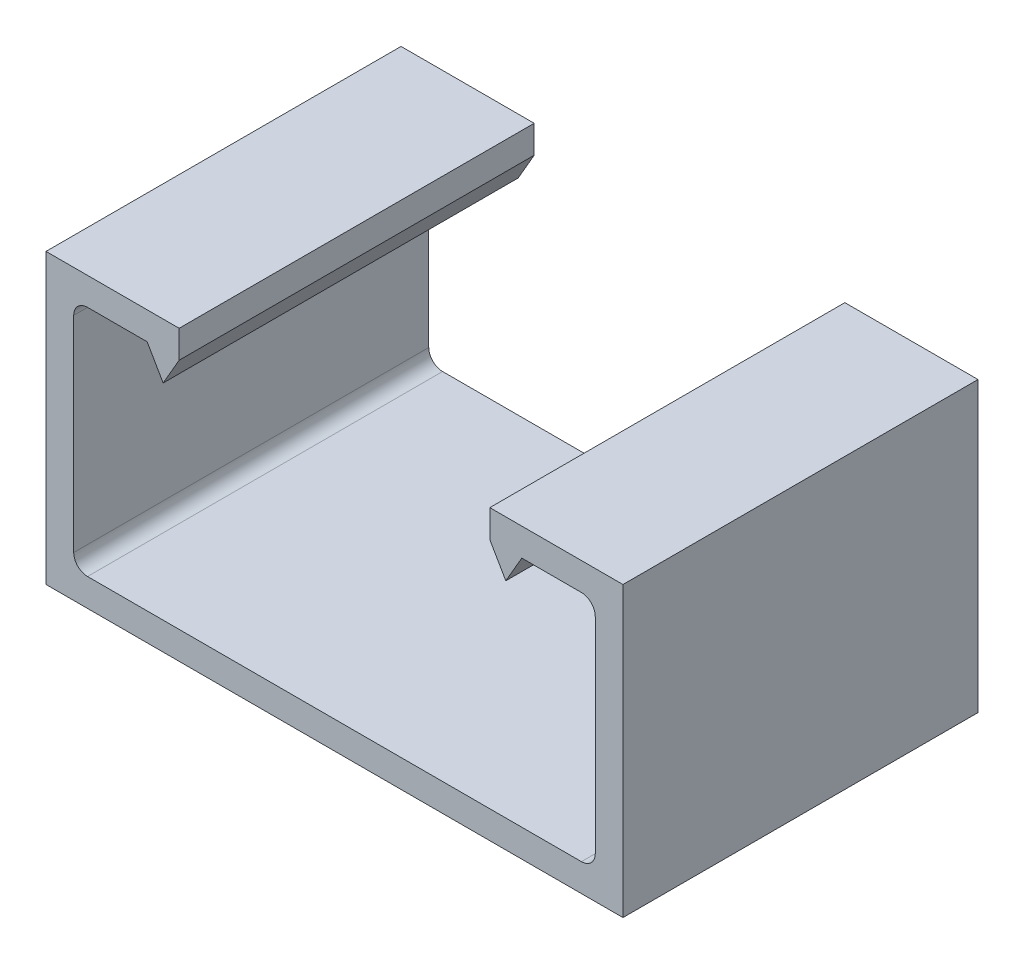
SolidWorks part; units mm, degrees
ref_plane "Plane1" through (0, 0, 0) normal (0, 0, 1) x (1, 0, 0)
ref_plane "Plane2" through (0, 0, 0) normal (0, 1, 0) x (1, 0, 0)
ref_plane "Plane3" through (0, 0, 0) normal (1, 0, 0) x (0, 0, -1)
sketch "Sketch1" plane through (0, 0, 0) normal (0, 0, 1) x (1, 0, 0)
  line L0 (-11.1125, 10.3187) -> (-20.6375, 10.3187)
  line L1 (-20.6375, 10.3187) -> (-20.6375, -10.3187)
  line L2 (-20.6375, -10.3187) -> (20.6375, -10.3187)
  line L3 (20.6375, -10.3187) -> (20.6375, 10.3188)
  line L4 (20.6375, 10.3188) -> (11.1125, 10.3188)
  line L5 (17.6657, 8.3376) -> (13.4002, 8.3376)
  line L6 (18.6563, -7.3469) -> (18.6563, 7.347)
  line L7 (-17.6657, -8.3375) -> (17.6657, -8.3375)
  line L8 (-18.6563, 7.3469) -> (-18.6563, -7.3469)
  line L9 (-13.4002, 8.3375) -> (-17.6657, 8.3375)
  line L10 (13.4002, 8.3376) -> (12.2563, 6.3564)
  line L11 (12.2563, 6.3564) -> (11.1125, 8.3376)
  line L12 (11.1125, 8.3376) -> (11.1125, 10.3188)
  line L13 (-13.4002, 8.3375) -> (-12.2563, 6.3563)
  line L14 (-12.2563, 6.3563) -> (-11.1125, 8.3376)
  line L15 (-11.1125, 8.3376) -> (-11.1125, 10.3187)
  arc A0 (-18.6563, -7.3469) -> (-17.6657, -8.3375) centre (-17.6657, -7.3469) ccw
  arc A1 (-17.6657, 8.3375) -> (-18.6563, 7.3469) centre (-17.6657, 7.3469) ccw
  arc A2 (18.6563, 7.347) -> (17.6657, 8.3376) centre (17.6657, 7.347) ccw
  arc A3 (17.6657, -8.3375) -> (18.6563, -7.3469) centre (17.6657, -7.3469) ccw
  dimension "D5" = 0.9906
  dimension "D4" = 60
  dimension "Width" = 41.275
  dimension "Height" = 20.6375
  dimension "D8" = 20.6375
  dimension "D9" = 10.3187
  dimension "D10" = 22.225
  dimension "edge" = 9.525
  dimension "D13" = 1.1438
extrude "Base-Extrude" add sketch "Sketch1" along normal mid plane 25.4
equation "\"D8@Sketch1\" = \"Width@Sketch1\" / 2"
equation "\"D9@Sketch1\" = \"Height@Sketch1\" / 2"
equation "\"D10@Sketch1\" = \"Width@Sketch1\" - 2 * \"edge@Sketch1\""
equation "\"D5@Sketch1\" = \"gauge@Sketch1\" / 2"
equation "\"D13@Sketch1\" = \"gauge@Sketch1\" * .577350269"
